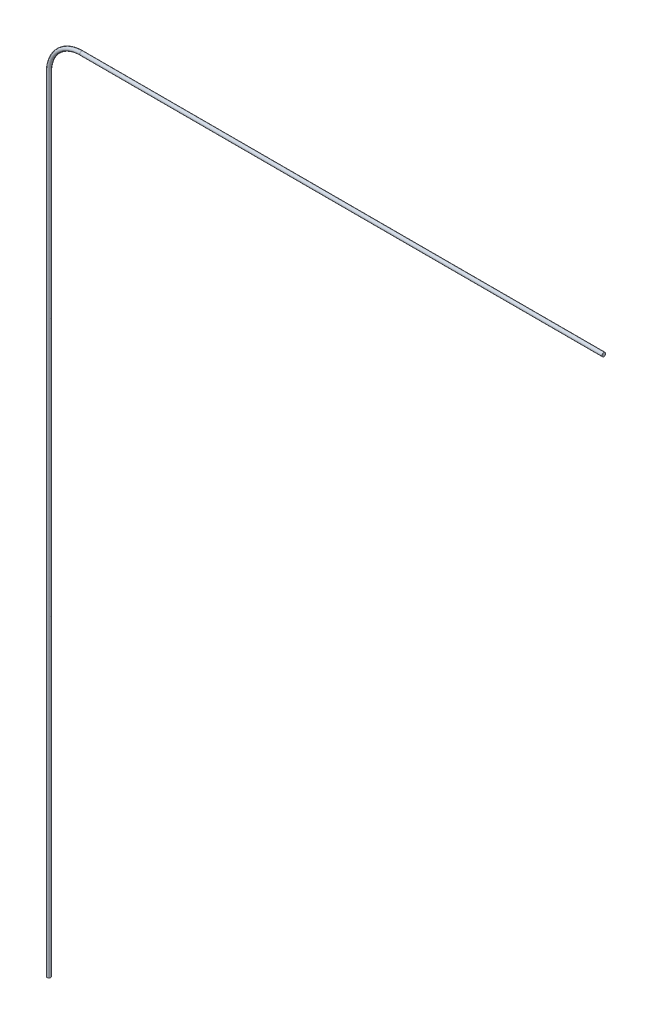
SolidWorks part; units mm, degrees
ref_plane "Front Plane" through (0, 0, 0) normal (0, 0, 1) x (1, 0, 0)
ref_plane "Top Plane" through (0, 0, 0) normal (0, 1, 0) x (1, 0, 0)
ref_plane "Right Plane" through (0, 0, 0) normal (1, 0, 0) x (0, 0, -1)
sketch "Sketch1" plane through (0, 0, 0) normal (0, 1, 0) x (1, 0, 0)
  circle A0 centre (0, 0) radius 0.18
  dimension "D1" = 0.3599
sketch "Sketch2" plane through (0, 0, 0) normal (0, 0, 1) x (1, 0, 0)
  line L0 (0, 0) -> (0, -76.2)
  line L1 (3.175, 3.175) -> (53.975, 3.175)
  arc A0 (0, 0) -> (3.175, 3.175) centre (3.175, 0) cw
  dimension "D1" = 3.175
  dimension "D2" = 76.2
  dimension "D3" = 50.8
sweep "Sweep1" add profiles "Sketch1" path "Sketch2"
